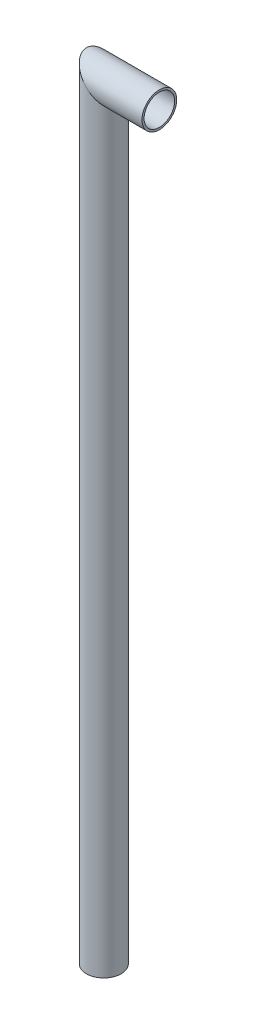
SolidWorks part; units mm, degrees
ref_plane "Alzado" through (0, 0, 0) normal (0, 0, 1) x (1, 0, 0)
ref_plane "Planta" through (0, 0, 0) normal (0, 1, 0) x (1, 0, 0)
ref_plane "Vista lateral" through (0, 0, 0) normal (1, 0, 0) x (0, 0, -1)
sketch "Croquis1" plane through (0, 0, 0) normal (0, 1, 0) x (1, 0, 0)
  circle A0 centre (0, 0) radius 6.25
  circle A1 centre (0, 0) radius 5.5
  dimension "D1" = 12.5
  dimension "D2" = 11
sketch "Croquis2" plane through (0, 0, 0) normal (0, 0, 1) x (1, 0, 0)
  line L0 (0, 0) -> (0, 276.22)
  line L1 (6.25, 0) -> (-6.25, 0) construction
  line L2 (0, 276.22) -> (20, 276.22)
  dimension "D1" = 276.22
  dimension "D2" = 20
sweep "Barrer1" add profiles "Croquis1" path "Croquis2"
